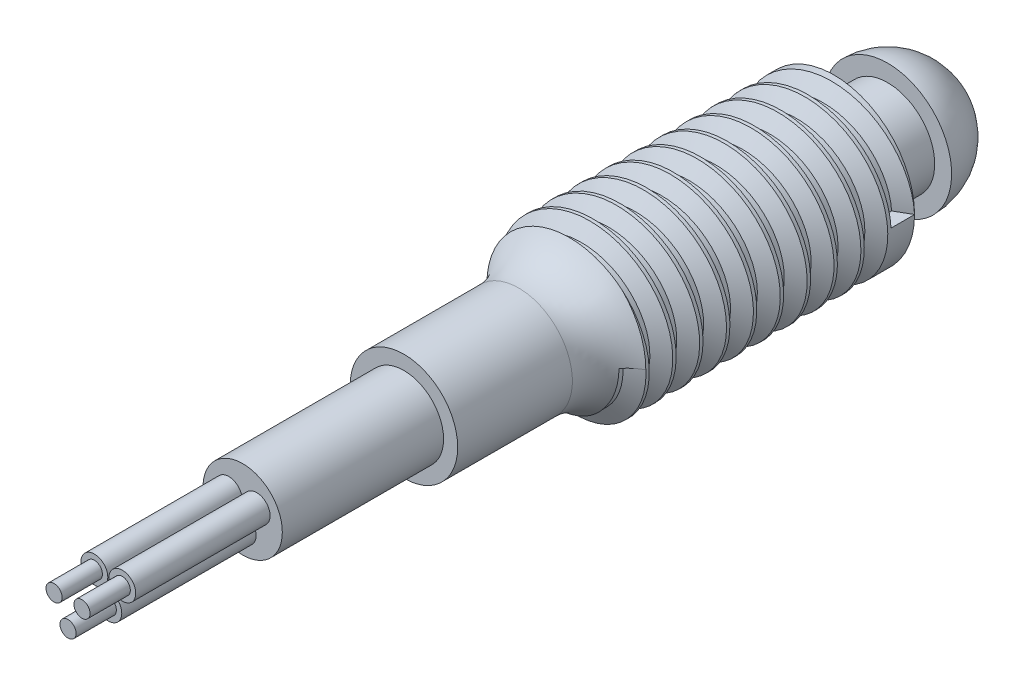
SolidWorks part; units mm, degrees
ref_plane "Front Plane" through (0, 0, 0) normal (0, 0, 1) x (1, 0, 0)
ref_plane "Top Plane" through (0, 0, 0) normal (0, 1, 0) x (1, 0, 0)
ref_plane "Right Plane" through (0, 0, 0) normal (1, 0, 0) x (0, 0, -1)
sketch "Sketch2" plane through (0, 0, 0) normal (0, 0, 1) x (1, 0, 0)
  line L0 (0, 3.833) -> (0, -4.6433) construction
  line L1 (0, 2.38) -> (0, -2.38)
  arc A0 (0, 2.38) -> (0, -2.38) centre (0, 0) ccw
  dimension "D1" = 4.76
revolve "Revolve2" add sketch "Sketch2" angle 180 about L0
sketch "Sketch3" plane through (0, 0, 0) normal (0, 0, 1) x (1, 0, 0)
  circle A0 centre (0, 0) radius 1.75
  dimension "D1" = 3.5
extrude "Boss-Extrude1" add sketch "Sketch3" along normal blind 2
sketch "Sketch4" plane through (0, 0, 2) normal (0, 0, 1) x (1, 0, 0)
  circle A0 centre (0, 0) radius 3
  dimension "D1" = 6
extrude "Boss-Extrude2" add sketch "Sketch4" along normal blind 10
sketch "Sketch5" plane through (0, 0, 12) normal (0, 0, 1) x (1, 0, 0)
  circle A0 centre (0, 0) radius 2
  dimension "D1" = 4
extrude "Boss-Extrude3" add sketch "Sketch5" along normal blind 6
fillet "Fillet1" radius 2 1 edges at (2, 0, 12)
sketch "Sketch6" plane through (0, 0, 18) normal (0, 0, 1) x (1, 0, 0)
  circle A0 centre (0, 0) radius 1.4745
extrude "Boss-Extrude4" add sketch "Sketch6" along normal blind 6
sketch "Sketch7" plane through (0, 0, 24) normal (0, 0, 1) x (1, 0, 0)
  line L0 (0, 0) -> (0, -0.6) construction
  line L1 (0, -0.6) -> (0.5196, 0.3) construction
  line L2 (0.5196, 0.3) -> (-0.5196, 0.3) construction
  line L3 (-0.5196, 0.3) -> (0, -0.6) construction
  circle A0 centre (0, 0) radius 0.3 construction
  circle A1 centre (-0.5196, 0.3) radius 0.5
  circle A2 centre (0.5196, 0.3) radius 0.5
  circle A3 centre (0, -0.6) radius 0.5
  dimension "D1" = 0.6
  dimension "D2" = 1
extrude "Boss-Extrude5" add sketch "Sketch7" along normal blind 5
sketch "Sketch8" plane through (0, 0, 29) normal (0, 0, 1) x (1, 0, 0)
  circle A0 centre (-0.5196, 0.3) radius 0.3
  circle A1 centre (0.5196, 0.3) radius 0.3
  circle A2 centre (0, -0.6) radius 0.3
  dimension "D1" = 0.6
extrude "Boss-Extrude6" add sketch "Sketch8" along normal blind 1.5
thread "Thread1" pitch 1 start angle 0, offset 0, length 10, pitch 1, diameter 6
ref_plane "Plane1" through (3, 0, 2) normal (0, -1, 0) x (1, 0, 0)
sketch "Thread Profile1" plane through (3, 0, 2) normal (0, -1, 0) x (1, 0, 0)
  line L0 (0, 0) -> (0, 1) construction
  line L11 (0, 0) -> (0, 0.875)
  line L12 (0, 0.875) -> (-0.5413, 0.5625)
  line L13 (-0.5413, 0.5625) -> (-0.5413, 0.3125)
  line L15 (-0.5413, 0.3125) -> (0, 0)
  line L17 (-0.5413, 0.4375) -> (0, 0.4375) construction
  point P2 (0, 0)
  dimension "Pitch" = 1
  dimension "Profile_Angle" = 60
  dimension "Profile_Land" = 0.25
  dimension "Profile_Height" = 0.5413
